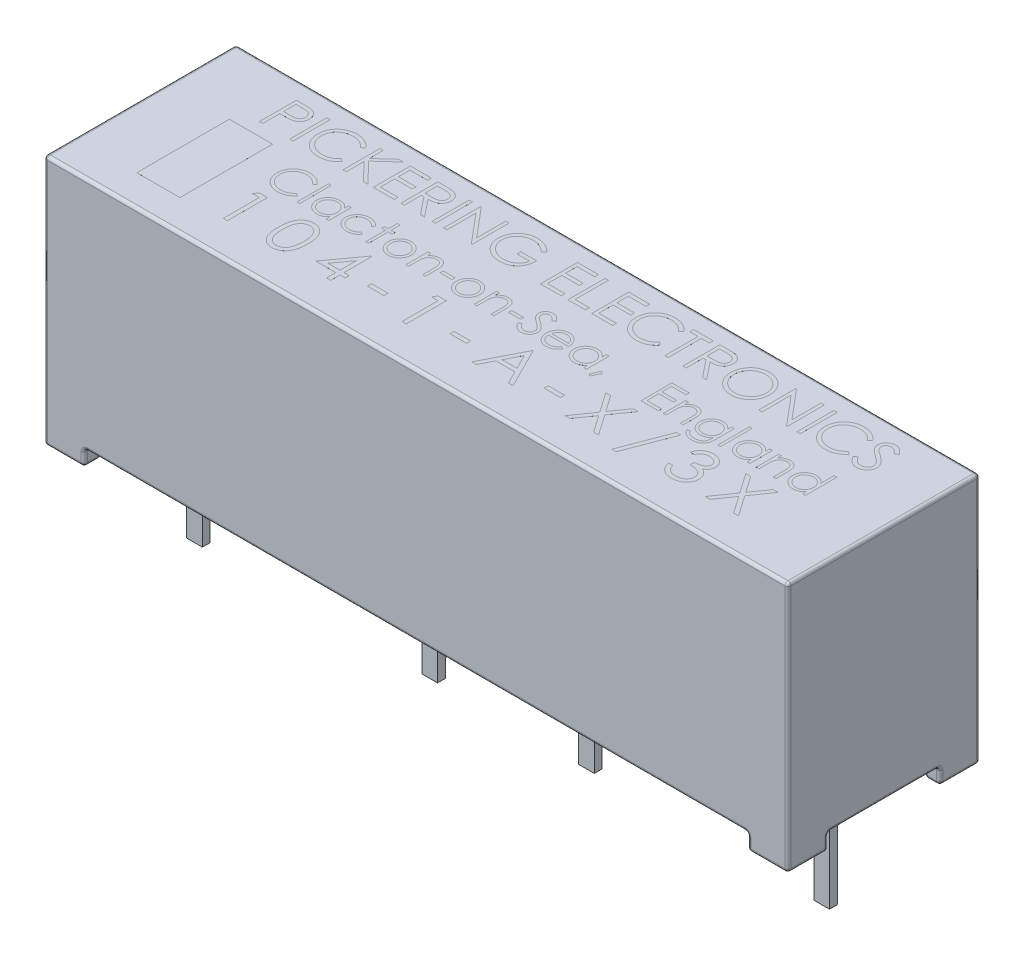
SolidWorks part; units mm, degrees
ref_plane "Front Plane" through (0, 0, 0) normal (0, 0, 1) x (1, 0, 0)
ref_plane "Top Plane" through (0, 0, 0) normal (0, 1, 0) x (1, 0, 0)
ref_plane "Right Plane" through (0, 0, 0) normal (1, 0, 0) x (0, 0, -1)
sketch "Sketch1" plane through (0, 0, 0) normal (0, 1, 0) x (1, 0, 0)
  line L1 (12.05, -3.11) -> (-12.05, -3.11)
  line L2 (12.05, -3.11) -> (12.05, 3.11)
  line L3 (12.05, 3.11) -> (-12.05, 3.11)
  line L4 (-12.05, -3.11) -> (-12.05, 3.11)
  line L5 (12.05, -3.11) -> (-12.05, 3.11) construction
  line L6 (12.05, 3.11) -> (-12.05, -3.11) construction
  point P0 (0, 0)
  dimension "D1" = 6.22
  dimension "D2" = 24.1
extrude "Main Body" add sketch "Sketch1" along normal blind 7.622
sketch "Sketch2" plane through (0, 0, 0) normal (0, -1, 0) x (1, 0, 0)
  line L1 (-12.05, 3.11) -> (-10.75, 3.11)
  line L2 (-12.05, 3.11) -> (-12.05, 1.81)
  line L3 (-12.05, 1.81) -> (-11.5605, 1.81)
  line L4 (-10.75, 3.11) -> (-10.75, 2.5307)
  line L7 (-10.75, 2.5307) -> (-11.5605, 2.5307)
  line L8 (-11.5605, 1.81) -> (-11.5605, 2.5307)
  dimension "D1" = 1.3
  dimension "D2" = 1.3
extrude "Original foot" add sketch "Sketch2" along normal blind 0.508
mirror "Left foot" about plane through (0, 0, 0) normal (0, 0, 1) of "Original foot"
mirror "Right Feet" about plane through (0, 0, 0) normal (1, 0, 0) of "Left foot", "Original foot"
sketch "Sketch3" plane through (0, 0, 0) normal (0, -1, 0) x (1, 0, 0)
  line L1 (-9.906, -0.127) -> (-10.414, -0.127)
  line L2 (-9.906, -0.127) -> (-9.906, 0.127)
  line L3 (-9.906, 0.127) -> (-10.414, 0.127)
  line L4 (-10.414, -0.127) -> (-10.414, 0.127)
  line L5 (-9.906, -0.127) -> (-10.414, 0.127) construction
  line L6 (-9.906, 0.127) -> (-10.414, -0.127) construction
  line L7 (-2.794, -0.127) -> (-2.286, -0.127)
  line L8 (-2.794, -0.127) -> (-2.794, 0.127)
  line L9 (-2.794, 0.127) -> (-2.286, 0.127)
  line L10 (-2.286, -0.127) -> (-2.286, 0.127)
  line L11 (-2.794, -0.127) -> (-2.286, 0.127) construction
  line L12 (-2.794, 0.127) -> (-2.286, -0.127) construction
  line L13 (10.414, -0.127) -> (9.906, -0.127)
  line L14 (10.414, -0.127) -> (10.414, 0.127)
  line L15 (10.414, 0.127) -> (9.906, 0.127)
  line L16 (9.906, -0.127) -> (9.906, 0.127)
  line L17 (10.414, -0.127) -> (9.906, 0.127) construction
  line L18 (10.414, 0.127) -> (9.906, -0.127) construction
  line L19 (2.286, -0.127) -> (2.794, -0.127)
  line L20 (2.286, -0.127) -> (2.286, 0.127)
  line L21 (2.286, 0.127) -> (2.794, 0.127)
  line L22 (2.794, -0.127) -> (2.794, 0.127)
  line L23 (2.286, -0.127) -> (2.794, 0.127) construction
  line L24 (2.286, 0.127) -> (2.794, -0.127) construction
  point P0 (-10.16, 0)
  point P5 (-2.54, 0)
  point P10 (10.16, 0)
  point P15 (2.54, 0)
  dimension "D1" = 0.508
  dimension "D2" = 0.254
  dimension "D3" = 0.508
  dimension "D4" = 0.254
  dimension "D5" = 0.508
  dimension "D6" = 0.254
  dimension "D7" = 0.508
  dimension "D8" = 0.254
  dimension "D9" = 7.62
  dimension "D10" = 5.08
  dimension "D11" = 7.62
extrude "Pins" add sketch "Sketch3" along normal blind 3.808
sketch "Sketch4"
  dimension "D1" = 19.3
  dimension "D2" = 17.5
  dimension "D3" = 17.5
  dimension "D4" = 1.8
  dimension "D5" = 1.65
  dimension "D6" = 1.65
  dimension "D7" = 2.4
  dimension "D8" = 3
  dimension "D9" = 1.4
  dimension "D10" = 2
  dimension "D11" = 1
extrude "Lettering" add sketch "Sketch4" along normal blind 0.0001
fillet "Fillet1" radius 0.1 72 edges at (11.5605, -0.254, -1.81) (12.05, -0.254, -1.81) (12.05, -0.254, 1.81) (11.5605, -0.254, 1.81) (11.1553, 0, -2.5307) (11.8053, 0, -1.81) (11.8053, 0, 1.81) (11.1553, 0, 2.5307) (-11.1553, 0, 2.5307) (-11.1553, 0, -2.5307) (-11.1553, -0.508, -2.5307) (-11.4, -0.508, -3.11) (-12.05, -0.508, -2.46) (10.75, -0.254, -2.5307) (10.75, -0.254, -3.11) (10.75, 0, -2.8203) (11.5605, -0.254, -2.5307) (11.5605, 0, -2.1703) (11.5605, -0.254, 2.5307) (11.5605, 0, 2.1703) (10.75, -0.254, 2.5307) (10.75, -0.254, 3.11) (10.75, 0, 2.8203) (-11.5605, -0.254, 1.81) (-11.5605, -0.254, 2.5307) (-11.5605, 0, 2.1703) (-10.75, -0.254, 2.5307) (-11.8053, -0.508, -1.81) (-12.05, -0.254, -1.81) (-11.5605, -0.254, -1.81) (-11.8053, 0, -1.81) (-11.5605, -0.254, -2.5307) (-11.5605, -0.508, -2.1703) (-11.5605, 0, -2.1703) (-10.75, -0.254, -2.5307) (-10.75, -0.254, -3.11) (-10.75, -0.508, -2.8203) (-10.75, 0, -2.8203) (-11.4, -0.508, 3.11) (-10.75, -0.508, 2.8203) (-11.1553, -0.508, 2.5307) (-11.5605, -0.508, 2.1703) (-11.8053, -0.508, 1.81) (-12.05, -0.508, 2.46) (11.4, -0.508, -3.11) (10.75, -0.508, -2.8203) (11.1553, -0.508, -2.5307) (11.5605, -0.508, -2.1703) (11.8053, -0.508, -1.81) (12.05, -0.508, -2.46) (11.8053, -0.508, 1.81) (11.5605, -0.508, 2.1703) (11.1553, -0.508, 2.5307) (10.75, -0.508, 2.8203) (11.4, -0.508, 3.11) (12.05, -0.508, 2.46) (12.05, 0, 0) (0, 0, -3.11) (0, 7.622, -3.11) (12.05, 3.557, -3.11) (12.05, 7.622, 0) (12.05, 3.557, 3.11) (0, 7.622, 3.11) (-12.05, 7.622, 0) (-12.05, 3.557, -3.11) (-12.05, 3.557, 3.11)
